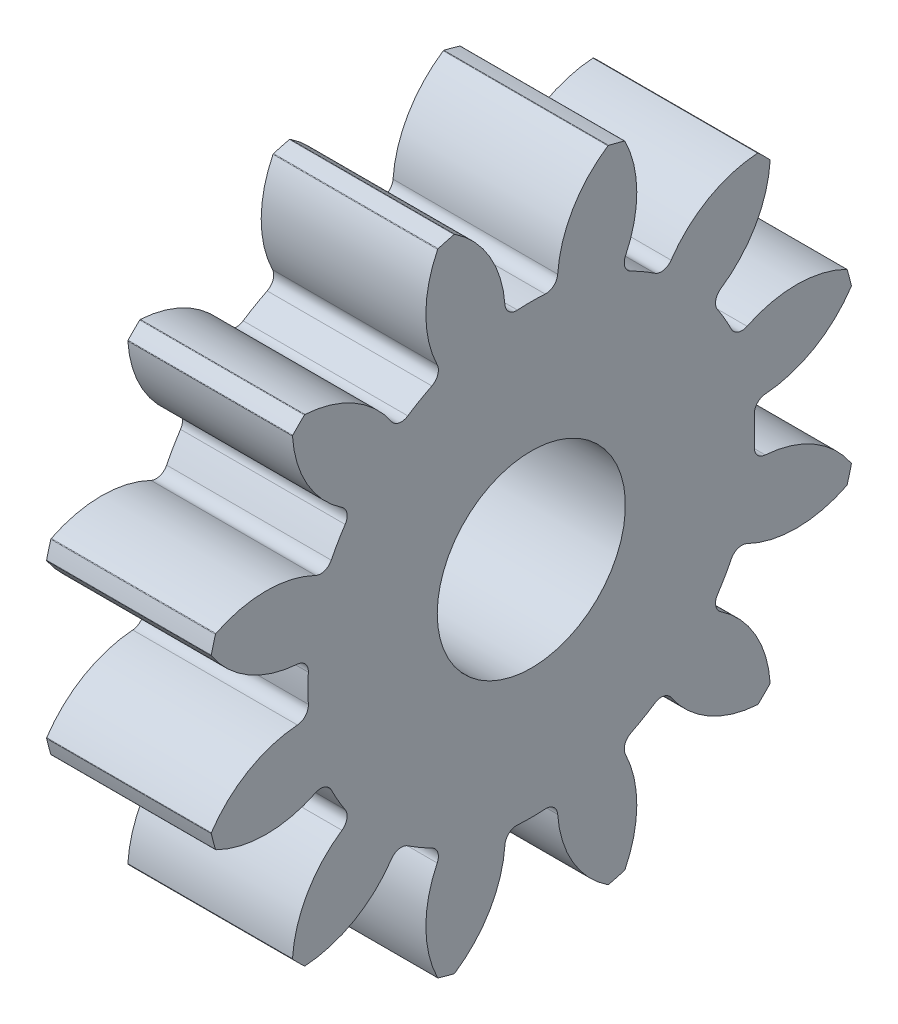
SolidWorks part; units mm, degrees
ref_plane "Plane1" through (0, 0, 0) normal (0, 0, 1) x (1, 0, 0)
ref_plane "Plane2" through (0, 0, 0) normal (0, 1, 0) x (1, 0, 0)
ref_plane "Plane3" through (0, 0, 0) normal (1, 0, 0) x (0, 0, -1)
sketch "HoldingSke" plane through (0, 0, 0) normal (0, 1, 0) x (1, 0, 0)
  line L0 (0, 0) -> (0.4891, -0.104)
  line L1 (-15, 0) -> (100, 0) construction
  line L2 (0, 0) -> (-2.1039, 2.3779)
  line L3 (0, 0) -> (-11.863, 4.5341)
  line L4 (0, 0) -> (8.4473, 1.7955)
  line L5 (0, 0) -> (-46.8476, -17.4728)
  line L6 (0, 0) -> (-5.8027, -3.9151)
  line L7 (-2.1039, 2.3779) -> (8.6586, 51.2059)
  line L8 (-76.2, 54.61) -> (-76.1, 54.61)
  line L9 (-71.009, 38.7566) -> (-53.1078, 45.2721)
  line L10 (-76.2, 71.12) -> (104.1128, 71.12)
  line L11 (0, 0) -> (-7, 0)
  line L12 (-76.2, 101.6) -> (-76.133, 101.6)
  line L13 (24.9733, 27.94) -> (52.9518, 28.4284)
  line L14 (24.9733, 27.94) -> (24.9743, 27.94)
  line L15 (24.9733, 27.94) -> (100.4006, 29.5858)
  line L16 (-63.627, -2) -> (-12.827, -2)
  circle A0 centre (0, 0) radius 0.4
  circle A1 centre (0, 0) radius 9.499
  circle A2 centre (0, 0) radius 37.5
  circle A3 centre (0, 0) radius 0.4
  dimension "MHD" = 18.998
  dimension "Hub_dia" = 75
  dimension "Bore" = 0.8
  dimension "MBD" = 0.8
  dimension "Num_teeth" = 12
  dimension "Pitch_radius" = 180.3128
  dimension "Pitch" = 0.5
  dimension "Width" = 7
  dimension "Overall_len" = 50
  dimension "Show_teeth" = 12
  dimension "Thickness" = 7
  dimension "OAL" = 50.0001
  dimension "T_dim" = 0.1
  dimension "Ap" = 20
  dimension "H" = 19.05
  dimension "Backlash" = 0.067
  dimension "Addendum_fac" = 1
  dimension "Dedendum_fac" = 1.25
  dimension "Clearance_fac" = 0.25
  dimension "Dedendum_add" = 0.001
  dimension "Module" = 2
sketch "BasProSke" plane through (0, 0, 0) normal (0, 1, 0) x (1, 0, 0)
  line L0 (-10, 0) -> (60, 0) construction
  line L1 (0, 0) -> (0, 14)
  line L2 (0, 0) -> (7, 0)
  line L3 (7, 0) -> (7, 14)
  line L4 (7, 14) -> (0, 14)
  dimension "Diameter" = 28
  dimension "Thickness" = 7
revolve "Base-Revolve" add sketch "BasProSke" angle 360 about L0
sketch "TooCutSke" plane through (0, 0, 0) normal (1, 0, 0) x (0, 0, -1)
  line L1 (0, 0) -> (0, 107) construction
  line L2 (0, 0) -> (-1.6834, 11.8813) construction
  line L3 (0, 0) -> (-6.1662, 23.0126) construction
  line L4 (-1.6834, 11.8813) -> (-3.0831, 11.5063) construction
  arc A0 (1.1119, 9.4337) -> (-1.1119, 9.4337) centre (0, 0) ccw
  arc A1 (3.2981, 13.6321) -> (-3.2981, 13.6321) centre (0, 0) ccw
  circle A2 centre (0, 0) radius 12 construction
  circle A3 centre (0, 0) radius 11.2763 construction
  arc A4 (-1.1119, 9.4337) -> (-3.2981, 13.6321) centre (-5.9089, 9.6042) ccw
  arc A5 (3.2981, 13.6321) -> (1.1119, 9.4337) centre (5.9089, 9.6042) ccw
  dimension "Root_dia" = 18.998
  dimension "Overcut_dia" = 28.0508
  dimension "Pitch_dia" = 24
  dimension "Base_dia" = 22.5526
  dimension "Flank_rad" = 4.8
  dimension "Half_ang" = 15
  dimension "Half_CT" = 1.4491
extrude "ToothCut" cut sketch "TooCutSke" along normal through all
fillet "Breaks" radius 0.04 2 edges at (3.5, 13.613, -3.2689) (3.5, 13.613, 3.2689)
fillet "RootFillets" radius 0.501 2 edges at (3.5, 9.4337, -1.1119) (3.5, 9.4337, 1.1119)
pattern_circular "TeethCuts" count 12 every 30 about axis through (-10, 0, 0) along (1, 0, 0) of "ToothCut", "RootFillets", "Breaks"
sketch "HubNeaOneSke" plane through (0, 0, 0) normal (-1, 0, 0) x (0, 0, 1)
  circle A0 centre (0, 0) radius 9.499
  dimension "Diameter" = 18.998
extrude "HubNearOne" [suppressed] add sketch "HubNeaOneSke" along normal blind 43.0001
sketch "HubNeaBotSke" plane through (0, 0, 0) normal (-1, 0, 0) x (0, 0, 1)
  circle A0 centre (0, 0) radius 9.499
  dimension "Diameter" = 18.998
extrude "HubNearBoth" [suppressed] add sketch "HubNeaBotSke" along normal blind 21.5
ref_plane "FarPln" through (7, 0, 0) normal (1, 0, 0) x (0, 0, -1)
sketch "HubFarSke" plane through (7, 0, 0) normal (1, 0, 0) x (0, 0, -1)
  circle A0 centre (0, 0) radius 9.499
  dimension "Diameter" = 18.998
extrude "HubFar" [suppressed] add sketch "HubFarSke" along normal blind 21.5
sketch "BorSke" plane through (0, 0, 0) normal (1, 0, 0) x (0, 0, -1)
  circle A0 centre (0, 0) radius 0.4
  dimension "Diameter" = 0.8
extrude "Bore" cut sketch "BorSke" along normal mid plane 100.0001
sketch "KeySke" plane through (0, 0, 0) normal (1, 0, 0) x (0, 0, -1)
  line L0 (-0.05, 0) -> (-0.05, 0.5)
  line L1 (-0.05, 0.5) -> (0.05, 0.5)
  line L2 (0.05, 0.5) -> (0.05, 0)
  line L3 (0, 0) -> (0, 34) construction
  line L4 (-0.05, 0) -> (0.05, 0)
  dimension "Offset" = 0.5
  dimension "Width" = 0.1
extrude "Keyway" [suppressed] cut sketch "KeySke" along normal mid plane 100.0001
pattern_circular "Keyway2" [suppressed] count 2 every 90 about axis through (-10, 0, 0) along (1, 0, 0)
sketch "草图1" plane through (0, 0, 0) normal (-1, 0, 0) x (0, 0, 1)
  circle A0 centre (0, 0) radius 4
  dimension "D1" = 8
extrude "切除-拉伸1" cut sketch "草图1" against normal through all
equation "' \"Module@HoldingSke\" = 6.35"
equation "' \"Num_teeth@HoldingSke\" = 12"
equation "' \"Ap@HoldingSke\" =  20"
equation "' \"Width@HoldingSke\" = 0.5 * 25.4"
equation "' \"Hub_dia@HoldingSke\"= 1 * 25.4"
equation "' \"Overall_len@HoldingSke\" = 1.0 * 25.4"
equation "' \"Bore@HoldingSke\" = 0.75 * 25.4"
equation "' \"T_dim@HoldingSke\" = 0.1 * 25.4"
equation "' \"Width@KeySke\" = 0.25 * 25.4"
equation "' \"Show_teeth@HoldingSke\" = 13"
equation "' \"Backlash@HoldingSke\" = 0.009 * 25.4"
equation "' \"Addendum_fac@HoldingSke\" = 1.0"
equation "' \"Dedendum_fac@HoldingSke\" = 1.25"
equation "' \"Dedendum_add@HoldingSke\" = 0.00005 * 25.4"
equation "' \"Clearance_fac@HoldingSke\" = 0.25"
equation "\"Pitch@HoldingSke\" = 1 / \"Module@HoldingSke\""
equation "\"Overcut_dia@TooCutSke\" = (\"Num_teeth@HoldingSke\" + 2 * \"Addendum_fac@HoldingSke\") / \"Pitch@HoldingSke\" + 0.002 * 25.4"
equation "\"Pitch_dia@TooCutSke\" = \"Num_teeth@HoldingSke\" / \"Pitch@HoldingSke\""
equation "\"Base_dia@TooCutSke\" = \"Num_teeth@HoldingSke\" / \"Pitch@HoldingSke\" * cos((\"Ap@HoldingSke\"  * 3.14159265 / 180))"
equation "\"Root_dia@TooCutSke\" = (\"Num_teeth@HoldingSke\" + 2) / \"Pitch@HoldingSke\" - 2 * (\"Addendum_fac@HoldingSke\" + \"Dedendum_fac@HoldingSke\") / \"Pitch@HoldingSke\" - \"Dedendum_add@HoldingSke\" * 2"
equation "\"Half_ang@TooCutSke\" = 180 / \"Num_teeth@HoldingSke\""
equation "\"Half_CT@TooCutSke\" = \"Num_teeth@HoldingSke\" / \"Pitch@HoldingSke\" * sin((3.14159265 / 2 / \"Num_teeth@HoldingSke\")) / 2 - 7 * \"Backlash@HoldingSke\" / 4"
equation "\"Flank_rad@TooCutSke\" = \"Num_teeth@HoldingSke\" / \"Pitch@HoldingSke\" / 5"
equation "\"Radius@RootFillets\" = \"Clearance_fac@HoldingSke\" / \"Pitch@HoldingSke\" + \"Dedendum_add@HoldingSke\""
equation "\"Break_rad@Breaks\" = 0.02 / \"Pitch@HoldingSke\""
equation "\"Thickness@HoldingSke\" = \"Width@HoldingSke\""
equation "\"OAL@HoldingSke\" = \"Thickness@HoldingSke\""
equation "\"MHD@HoldingSke\" = (\"Num_teeth@HoldingSke\" + 2) / \"Pitch@HoldingSke\" - 2 * (\"Addendum_fac@HoldingSke\" + \"Dedendum_fac@HoldingSke\")  / \"Pitch@HoldingSke\" - \"Dedendum_add@HoldingSke\" * 2"
equation "\"MBD@HoldingSke\" = (\"Num_teeth@HoldingSke\" + 2) / \"Pitch@HoldingSke\" - 2 * (\"Addendum_fac@HoldingSke\" + \"Dedendum_fac@HoldingSke\")  / \"Pitch@HoldingSke\" - \"Dedendum_add@HoldingSke\" * 2 - 0.002 * 25.4"
equation "\"MHD@HoldingSke\" = ((sgn( \"MHD@HoldingSke\" - \"Hub_dia@HoldingSke\" )-1)*( \"MHD@HoldingSke\" - \"Hub_dia@HoldingSke\" ))/-2+ \"Hub_dia@HoldingSke\""
equation "\"MBD@HoldingSke\" = ((sgn( \"MBD@HoldingSke\" - \"Bore@HoldingSke\" )-1)*( \"MBD@HoldingSke\" - \"Bore@HoldingSke\" ))/-2+ \"Bore@HoldingSke\""
equation "\"OAL@HoldingSke\" = ((sgn( \"OAL@HoldingSke\" - \"Overall_len@HoldingSke\" )+1)*( \"OAL@HoldingSke\" - \"Overall_len@HoldingSke\" ))/2 + \"Overall_len@HoldingSke\" + 0.000002 * 25.4"
equation "\"Num_teeth@TeethCuts\" = int( \"Show_teeth@HoldingSke\" ) + 1"
equation "\"Num_teeth@TeethCuts\" = ((sgn( \"Num_teeth@TeethCuts\" - \"Num_teeth@HoldingSke\" )-1)*( \"Num_teeth@TeethCuts\" - \"Num_teeth@HoldingSke\" ))/-2+ \"Num_teeth@HoldingSke\""
equation "\"Num_teeth@TeethCuts\" = ((sgn( \"Num_teeth@TeethCuts\" - 2.0)+1)*( \"Num_teeth@TeethCuts\" - 2.0))/2 +2.0"
equation "\"Angle@TeethCuts\" = 360.0 / \"Num_teeth@HoldingSke\""
equation "\"Diameter@BasProSke\" = (\"Num_teeth@HoldingSke\" + 2 * \"Addendum_fac@HoldingSke\") / \"Pitch@HoldingSke\""
equation "\"Thickness@BasProSke\"  = \"Thickness@HoldingSke\""
equation "' \"Fillet_rad@BasProSke\" =  \"Thickness@HoldingSke\" * 0.05"
equation "\"MHD@HoldingSke\" = ((sgn( \"MHD@HoldingSke\" - \"Root_dia@TooCutSke\" )-1)*( \"MHD@HoldingSke\" - \"Root_dia@TooCutSke\" ))/-2+ \"Root_dia@TooCutSke\""
equation "\"Diameter@HubNeaOneSke\" = \"MHD@HoldingSke\""
equation "\"Length@HubNearOne\" = \"OAL@HoldingSke\" - \"Thickness@BasProSke\""
equation "\"Diameter@HubNeaBotSke\" = \"MHD@HoldingSke\""
equation "\"Length@HubNearBoth\" = ( \"OAL@HoldingSke\" - \"Thickness@BasProSke\" ) / 2.0"
equation "\"Thickness@FarPln\" = \"Thickness@BasProSke\""
equation "\"Diameter@HubFarSke\" = \"MHD@HoldingSke\""
equation "\"Length@HubFar\" = ( \"OAL@HoldingSke\" - \"Thickness@BasProSke\" ) / 2.0"
equation "\"Diameter@BorSke\" = \"MBD@HoldingSke\""
equation "\"D1@Bore\" = \"OAL@HoldingSke\" * 2.0"
equation "\"D1@Keyway\" = \"OAL@HoldingSke\" * 2.0"
equation "\"Offset@KeySke\" = \"T_dim@HoldingSke\" + \"MBD@HoldingSke\" / 2.0"
